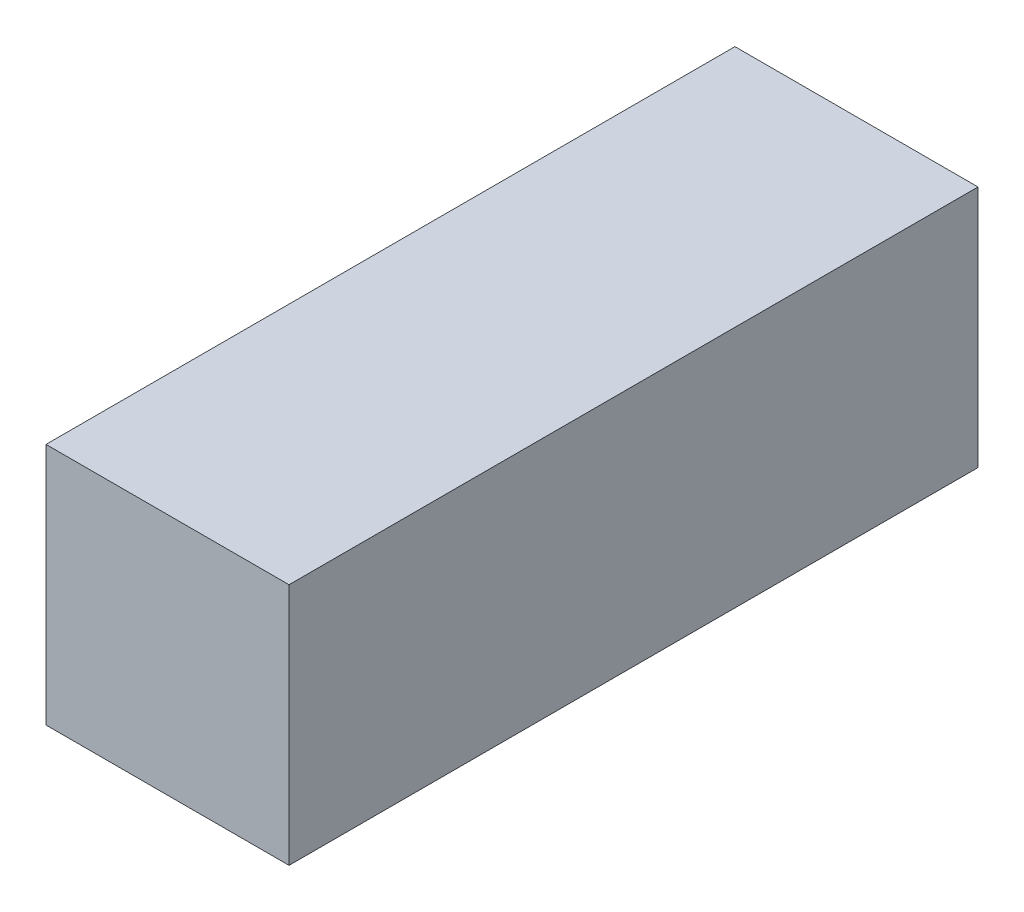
SolidWorks part; units mm, degrees
ref_plane "Front Plane" through (0, 0, 0) normal (0, 0, 1) x (1, 0, 0)
ref_plane "Top Plane" through (0, 0, 0) normal (0, 1, 0) x (1, 0, 0)
ref_plane "Right Plane" through (0, 0, 0) normal (1, 0, 0) x (0, 0, -1)
sketch "Sketch1" plane through (0, 0, 0) normal (0, 0, 1) x (1, 0, 0)
  line L1 (-1.5875, 1.5875) -> (1.5875, 1.5875)
  line L2 (-1.5875, 1.5875) -> (-1.5875, -1.5875)
  line L3 (-1.5875, -1.5875) -> (1.5875, -1.5875)
  line L4 (1.5875, 1.5875) -> (1.5875, -1.5875)
  line L5 (-1.5875, 1.5875) -> (1.5875, -1.5875) construction
  line L6 (-1.5875, -1.5875) -> (1.5875, 1.5875) construction
  point P0 (0, 0)
  dimension "D1" = 3.175
  dimension "D2" = 3.175
extrude "Boss-Extrude1" add sketch "Sketch1" along normal blind 9
